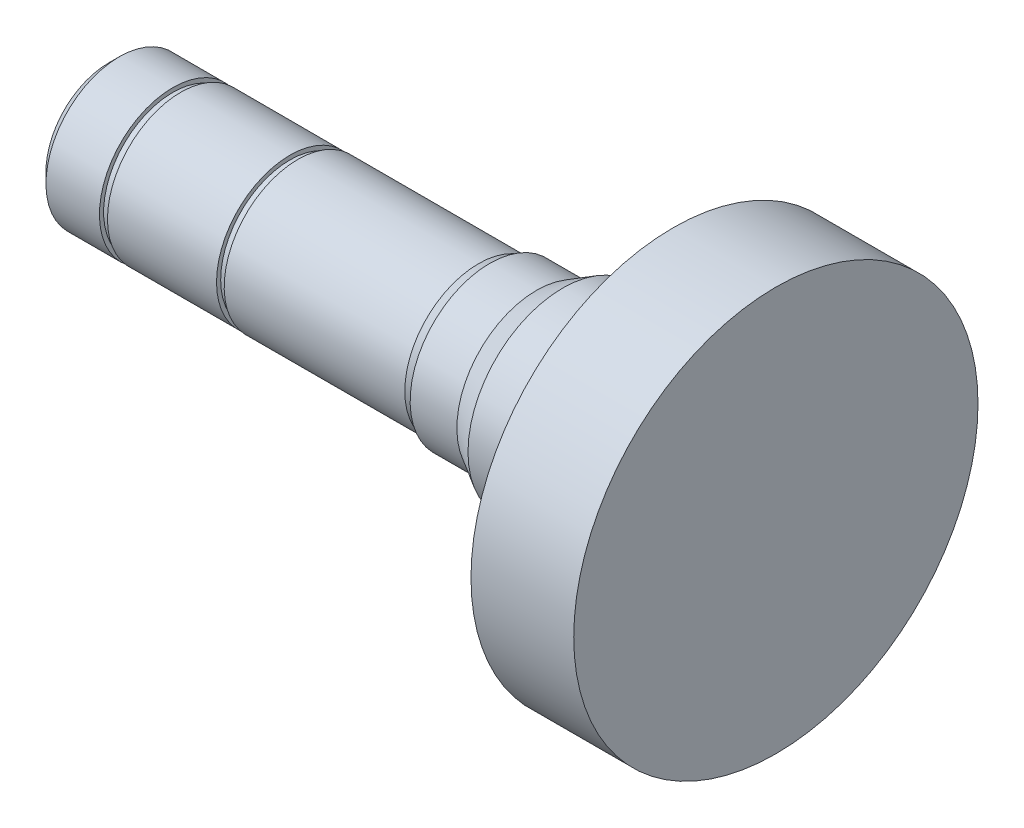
SolidWorks part; units mm, degrees
ref_plane "Plan de face" through (0, 0, 0) normal (0, 0, 1) x (1, 0, 0)
ref_plane "Plan de dessus" through (0, 0, 0) normal (0, 1, 0) x (1, 0, 0)
ref_plane "Plan de droite" through (0, 0, 0) normal (1, 0, 0) x (0, 0, -1)
imported_body "Importée3"
ref_plane "Plan1" through (44.9, 0, 0) normal (1, 0, 0) x (0, 0, -1)
sketch "Esquisse1" plane through (44.9, 0, 0) normal (1, 0, 0) x (0, 0, -1)
  line L0 (2.9725, 16.169) -> (2.9725, 17.1696)
  line L1 (-2.9725, 17.1696) -> (-2.9725, 16.169)
  arc A0 (2.9725, 17.1696) -> (-2.9725, 17.1696) centre (0, 0) ccw
  arc A1 (-2.9725, 16.169) -> (2.9725, 16.169) centre (0, 0) cw
extrude "Enlèv. mat.-Extru.1" cut sketch "Esquisse1" against normal blind 0.9
sketch "Esquisse2" plane through (44.9, 0, 0) normal (1, 0, 0) x (0, 0, -1)
  line L0 (-10.0389, -14.2426) -> (-9.3314, -13.5351)
  line L1 (-13.5351, -9.3314) -> (-14.2426, -10.0389)
  arc A0 (-14.2426, -10.0389) -> (-10.0389, -14.2426) centre (0, 0) ccw
  arc A1 (-9.3314, -13.5351) -> (-13.5351, -9.3314) centre (0, 0) cw
extrude "Enlèv. mat.-Extru.2" cut sketch "Esquisse2" against normal blind 0.9
sketch "Esquisse3" plane through (44.9, 0, 0) normal (1, 0, 0) x (0, 0, -1)
  line L0 (-2.9725, -16.169) -> (-2.9725, -17.1696)
  line L1 (2.9725, -17.1696) -> (2.9725, -16.169)
  arc A0 (-2.9725, -17.1696) -> (2.9725, -17.1696) centre (0, 0) ccw
  arc A1 (2.9725, -16.169) -> (-2.9725, -16.169) centre (0, 0) cw
extrude "Enlèv. mat.-Extru.3" cut sketch "Esquisse3" against normal blind 0.9
sketch "Esquisse4" plane through (44.9, 0, 0) normal (1, 0, 0) x (0, 0, -1)
  line L0 (-14.2426, 10.0389) -> (-13.5351, 9.3314)
  line L1 (-9.3314, 13.5351) -> (-10.0389, 14.2426)
  arc A0 (-10.0389, 14.2426) -> (-14.2426, 10.0389) centre (0, 0) ccw
  arc A1 (-13.5351, 9.3314) -> (-9.3314, 13.5351) centre (0, 0) cw
extrude "Enlèv. mat.-Extru.4" cut sketch "Esquisse4" against normal blind 0.9
sketch "Esquisse5" plane through (44.9, 0, 0) normal (1, 0, 0) x (0, 0, -1)
  line L0 (-17.1696, -2.9725) -> (-16.169, -2.9725)
  line L1 (-16.169, 2.9725) -> (-17.1696, 2.9725)
  arc A0 (-17.1696, 2.9725) -> (-17.1696, -2.9725) centre (0, 0) ccw
  arc A1 (-16.169, -2.9725) -> (-16.169, 2.9725) centre (0, 0) cw
extrude "Enlèv. mat.-Extru.5" cut sketch "Esquisse5" against normal blind 0.9
sketch "Esquisse6" plane through (44.9, 0, 0) normal (1, 0, 0) x (0, 0, -1)
  line L0 (9.3314, -13.5351) -> (10.0389, -14.2426)
  line L1 (14.2426, -10.0389) -> (13.5351, -9.3314)
  arc A0 (13.5351, -9.3314) -> (9.3314, -13.5351) centre (0, 0) cw
  arc A1 (10.0389, -14.2426) -> (14.2426, -10.0389) centre (0, 0) ccw
extrude "Enlèv. mat.-Extru.6" cut sketch "Esquisse6" against normal blind 0.9
sketch "Esquisse7" plane through (44.9, 0, 0) normal (1, 0, 0) x (0, 0, -1)
  line L0 (10.0389, 14.2426) -> (9.3314, 13.5351)
  line L1 (13.5351, 9.3314) -> (14.2426, 10.0389)
  arc A0 (14.2426, 10.0389) -> (10.0389, 14.2426) centre (0, 0) ccw
  arc A1 (9.3314, 13.5351) -> (13.5351, 9.3314) centre (0, 0) cw
extrude "Enlèv. mat.-Extru.7" cut sketch "Esquisse7" against normal blind 0.9
sketch "Esquisse8" plane through (44.9, 0, 0) normal (1, 0, 0) x (0, 0, -1)
  line L0 (17.1696, 2.9725) -> (16.169, 2.9725)
  line L1 (16.169, -2.9725) -> (17.1696, -2.9725)
  arc A0 (17.1696, -2.9725) -> (17.1696, 2.9725) centre (0, 0) ccw
  arc A1 (16.169, 2.9725) -> (16.169, -2.9725) centre (0, 0) cw
extrude "Enlèv. mat.-Extru.8" cut sketch "Esquisse8" against normal blind 0.9
sketch "Esquisse9" plane through (44, 0, 0) normal (1, 0, 0) x (0, 0, -1)
  line L0 (10.0389, 14.2426) -> (9.3314, 13.5351)
  line L1 (13.5351, 9.3314) -> (14.2426, 10.0389)
  arc A0 (14.2426, 10.0389) -> (10.0389, 14.2426) centre (0, 0) ccw
  arc A1 (9.3314, 13.5351) -> (13.5351, 9.3314) centre (0, 0) cw
extrude "Enlèv. mat.-Extru.9" cut sketch "Esquisse9" against normal blind 1
sketch "Esquisse10" plane through (44, 0, 0) normal (1, 0, 0) x (0, 0, -1)
  line L0 (17.1696, 2.9725) -> (16.169, 2.9725)
  line L1 (16.169, -2.9725) -> (17.1696, -2.9725)
  arc A0 (17.1696, -2.9725) -> (17.1696, 2.9725) centre (0, 0) ccw
  arc A1 (16.169, 2.9725) -> (16.169, -2.9725) centre (0, 0) cw
extrude "Enlèv. mat.-Extru.10" cut sketch "Esquisse10" against normal blind 1
sketch "Esquisse11" plane through (44, 0, 0) normal (1, 0, 0) x (0, 0, -1)
  line L0 (9.3314, -13.5351) -> (10.0389, -14.2426)
  line L1 (14.2426, -10.0389) -> (13.5351, -9.3314)
  arc A0 (13.5351, -9.3314) -> (9.3314, -13.5351) centre (0, 0) cw
  arc A1 (10.0389, -14.2426) -> (14.2426, -10.0389) centre (0, 0) ccw
extrude "Enlèv. mat.-Extru.11" cut sketch "Esquisse11" against normal blind 1
sketch "Esquisse12" plane through (44, 0, 0) normal (1, 0, 0) x (0, 0, -1)
  line L0 (-17.1696, -2.9725) -> (-16.169, -2.9725)
  line L1 (-16.169, 2.9725) -> (-17.1696, 2.9725)
  arc A0 (-17.1696, 2.9725) -> (-17.1696, -2.9725) centre (0, 0) ccw
  arc A1 (-16.169, -2.9725) -> (-16.169, 2.9725) centre (0, 0) cw
extrude "Enlèv. mat.-Extru.12" cut sketch "Esquisse12" against normal blind 1
sketch "Esquisse13" plane through (44, 0, 0) normal (1, 0, 0) x (0, 0, -1)
  line L0 (-14.2426, 10.0389) -> (-13.5351, 9.3314)
  line L1 (-9.3314, 13.5351) -> (-10.0389, 14.2426)
  arc A0 (-10.0389, 14.2426) -> (-14.2426, 10.0389) centre (0, 0) ccw
  arc A1 (-13.5351, 9.3314) -> (-9.3314, 13.5351) centre (0, 0) cw
extrude "Enlèv. mat.-Extru.13" cut sketch "Esquisse13" against normal blind 1
sketch "Esquisse14" plane through (44, 0, 0) normal (1, 0, 0) x (0, 0, -1)
  line L0 (-2.9725, -16.169) -> (-2.9725, -17.1696)
  line L1 (2.9725, -17.1696) -> (2.9725, -16.169)
  arc A0 (-2.9725, -17.1696) -> (2.9725, -17.1696) centre (0, 0) ccw
  arc A1 (2.9725, -16.169) -> (-2.9725, -16.169) centre (0, 0) cw
extrude "Enlèv. mat.-Extru.14" cut sketch "Esquisse14" against normal blind 1
sketch "Esquisse15" [suppressed] plane through (44, 0, 0) normal (1, 0, 0) x (0, 0, -1)
  line L0 (-10.0389, -14.2426) -> (-9.3314, -13.5351)
  line L1 (-13.5351, -9.3314) -> (-14.2426, -10.0389)
  arc A0 (-14.2426, -10.0389) -> (-10.0389, -14.2426) centre (0, 0) ccw
  arc A1 (-9.3314, -13.5351) -> (-13.5351, -9.3314) centre (0, 0) cw
extrude "Enlèv. mat.-Extru.15" [suppressed] cut sketch "Esquisse15" against normal blind 1
sketch "Esquisse16" [suppressed] plane through (44, 0, 0) normal (1, 0, 0) x (0, 0, -1)
  line L0 (2.9725, 16.169) -> (2.9725, 17.1696)
  line L1 (-2.9725, 17.1696) -> (-2.9725, 16.169)
  arc A0 (2.9725, 17.1696) -> (-2.9725, 17.1696) centre (0, 0) ccw
  arc A1 (-2.9725, 16.169) -> (2.9725, 16.169) centre (0, 0) cw
extrude "Enlèv. mat.-Extru.16" [suppressed] cut sketch "Esquisse16" against normal blind 1
ref_plane "Plan2" through (15.2, 0, 0) normal (-1, 0, 0) x (0, -1, 0)
sketch "Esquisse17" plane through (15.2, 0, 0) normal (-1, 0, 0) x (0, -1, 0)
  line L0 (16.169, -2.9725) -> (17.1696, -2.9725)
  line L1 (17.1696, 2.9725) -> (16.169, 2.9725)
  arc A0 (16.169, 2.9725) -> (16.169, -2.9725) centre (0, 0) cw
  arc A1 (17.1696, -2.9725) -> (17.1696, 2.9725) centre (0, 0) ccw
extrude "Enlèv. mat.-Extru.17" cut sketch "Esquisse17" against normal blind 1.9
sketch "Esquisse18" plane through (15.2, 0, 0) normal (-1, 0, 0) x (0, -1, 0)
  line L0 (10.0389, 14.2426) -> (9.3314, 13.5351)
  line L1 (13.5351, 9.3314) -> (14.2426, 10.0389)
  arc A0 (14.2426, 10.0389) -> (10.0389, 14.2426) centre (0, 0) ccw
  arc A1 (9.3314, 13.5351) -> (13.5351, 9.3314) centre (0, 0) cw
extrude "Enlèv. mat.-Extru.18" cut sketch "Esquisse18" against normal blind 1.9
ref_plane "Plan3" through (17.1, 0, 0) normal (1, 0, 0) x (0, 0, -1)
sketch "Esquisse19" plane through (17.1, 0, 0) normal (1, 0, 0) x (0, 0, -1)
  line L0 (-14.2426, 10.0389) -> (-13.5351, 9.3314)
  line L1 (-9.3314, 13.5351) -> (-10.0389, 14.2426)
  arc A0 (-10.0389, 14.2426) -> (-14.2426, 10.0389) centre (0, 0) ccw
  arc A1 (-13.5351, 9.3314) -> (-9.3314, 13.5351) centre (0, 0) cw
extrude "Enlèv. mat.-Extru.19" cut sketch "Esquisse19" against normal blind 1.9
sketch "Esquisse20" plane through (15.2, 0, 0) normal (-1, 0, 0) x (0, -1, 0)
  line L0 (-2.9725, 17.1696) -> (-2.9725, 16.169)
  line L1 (2.9725, 16.169) -> (2.9725, 17.1696)
  arc A0 (2.9725, 17.1696) -> (-2.9725, 17.1696) centre (0, 0) ccw
  arc A1 (-2.9725, 16.169) -> (2.9725, 16.169) centre (0, 0) cw
extrude "Enlèv. mat.-Extru.20" cut sketch "Esquisse20" against normal blind 1.9
sketch "Esquisse21" plane through (15.2, 0, 0) normal (-1, 0, 0) x (0, -1, 0)
  line L0 (9.3314, -13.5351) -> (10.0389, -14.2426)
  line L1 (14.2426, -10.0389) -> (13.5351, -9.3314)
  arc A0 (10.0389, -14.2426) -> (14.2426, -10.0389) centre (0, 0) ccw
  arc A1 (13.5351, -9.3314) -> (9.3314, -13.5351) centre (0, 0) cw
extrude "Enlèv. mat.-Extru.21" cut sketch "Esquisse21" against normal blind 1.9
sketch "Esquisse22" plane through (15.2, 0, 0) normal (-1, 0, 0) x (0, -1, 0)
  line L0 (2.9725, -17.1696) -> (2.9725, -16.169)
  line L1 (-2.9725, -16.169) -> (-2.9725, -17.1696)
  arc A0 (-2.9725, -17.1696) -> (2.9725, -17.1696) centre (0, 0) ccw
  arc A1 (2.9725, -16.169) -> (-2.9725, -16.169) centre (0, 0) cw
extrude "Enlèv. mat.-Extru.22" cut sketch "Esquisse22" against normal blind 1.9
sketch "Esquisse23" plane through (15.2, 0, 0) normal (-1, 0, 0) x (0, -1, 0)
  line L0 (-10.0389, -14.2426) -> (-9.3314, -13.5351)
  line L1 (-13.5351, -9.3314) -> (-14.2426, -10.0389)
  arc A0 (-14.2426, -10.0389) -> (-10.0389, -14.2426) centre (0, 0) ccw
  arc A1 (-9.3314, -13.5351) -> (-13.5351, -9.3314) centre (0, 0) cw
extrude "Enlèv. mat.-Extru.23" cut sketch "Esquisse23" against normal blind 1.9
sketch "Esquisse24" plane through (15.2, 0, 0) normal (-1, 0, 0) x (0, -1, 0)
  line L0 (-16.169, 2.9725) -> (-17.1696, 2.9725)
  line L1 (-17.1696, -2.9725) -> (-16.169, -2.9725)
  arc A0 (-16.169, -2.9725) -> (-16.169, 2.9725) centre (0, 0) cw
  arc A1 (-17.1696, 2.9725) -> (-17.1696, -2.9725) centre (0, 0) ccw
extrude "Enlèv. mat.-Extru.24" cut sketch "Esquisse24" against normal blind 1.9
sketch "Esquisse25" plane through (107.8, 0, 0) normal (1, 0, 0) x (0, 0, -1)
  circle A0 centre (0, 0) radius 22.5075
extrude "Boss.-Extru.1" add sketch "Esquisse25" along normal blind 26
ref_plane "Plan4" through (133.8, 0, 0) normal (-1, 0, 0) x (0, -1, 0)
sketch "Esquisse26" plane through (133.8, 0, 0) normal (-1, 0, 0) x (0, -1, 0)
  circle A0 centre (0, 0) radius 32
extrude "Boss.-Extru.2" add sketch "Esquisse26" against normal blind 0.2
ref_plane "Plan5" through (134, 0, 0) normal (-1, 0, 0) x (0, -1, 0)
sketch "Esquisse27" plane through (134, 0, 0) normal (-1, 0, 0) x (0, -1, 0)
  circle A0 centre (0, 0) radius 48
extrude "Boss.-Extru.3" add sketch "Esquisse27" against normal blind 22.4
ref_plane "Plan6" through (0, 0, 31.0515) normal (0, 0, -1) x (-1, 0, 0)
sketch "Esquisse28" plane through (0, 0, 31.0515) normal (0, 0, -1) x (-1, 0, 0)
  line L0 (-156.4, 5.1377) -> (-156.4, -7.0873)
  line L1 (-156.4, -7.0873) -> (-139.4053, -7.0873)
  line L2 (-139.4053, -7.0873) -> (-140.56, -5.0873)
  line L3 (-140.56, -5.0873) -> (-141.06, -5.0873)
  line L4 (-154.968, 4.1377) -> (-155.4, 4.1377)
  line L5 (-155.4, 4.1377) -> (-156.4, 5.1377)
  line L6 (-156.4, -7.0873) -> (-139.4053, -7.0873) construction
  arc A0 (-141.06, -5.0873) -> (-154.968, 4.1377) centre (-152.4, -7.0873) ccw
revolve "Enlèvement de matière-Révolution1" [suppressed] cut sketch "Esquisse28" angle 360 about L6
ref_plane "Plan7" through (0, 0, -24.9013) normal (0, 0, -1) x (-1, 0, 0)
sketch "Esquisse29" plane through (0, 0, -24.9013) normal (0, 0, -1) x (-1, 0, 0)
  line L0 (-156.4, 32.0831) -> (-156.4, 19.8581)
  line L1 (-156.4, 19.8581) -> (-139.4053, 19.8581)
  line L2 (-139.4053, 19.8581) -> (-140.56, 21.8581)
  line L3 (-140.56, 21.8581) -> (-141.06, 21.8581)
  line L4 (-154.968, 31.0831) -> (-155.4, 31.0831)
  line L5 (-155.4, 31.0831) -> (-156.4, 32.0831)
  line L6 (-156.4, 19.8581) -> (-139.4053, 19.8581) construction
  arc A0 (-141.06, 21.8581) -> (-154.968, 31.0831) centre (-152.4, 19.8581) ccw
revolve "Enlèvement de matière-Révolution2" [suppressed] cut sketch "Esquisse29" angle 360 about L6
ref_plane "Plan8" through (0, 0, 0) normal (0, 0, -1) x (-1, 0, 0)
sketch "Esquisse30" plane through (0, 0, 0) normal (0, 0, -1) x (-1, 0, 0)
  line L0 (-156.4, 44.075) -> (-156.4, 31.85)
  line L1 (-156.4, 31.85) -> (-139.4053, 31.85)
  line L2 (-139.4053, 31.85) -> (-140.56, 33.85)
  line L3 (-140.56, 33.85) -> (-141.06, 33.85)
  line L4 (-154.968, 43.075) -> (-155.4, 43.075)
  line L5 (-155.4, 43.075) -> (-156.4, 44.075)
  line L6 (-156.4, 31.85) -> (-139.4053, 31.85) construction
  arc A0 (-141.06, 33.85) -> (-154.968, 43.075) centre (-152.4, 31.85) ccw
revolve "Enlèvement de matière-Révolution3" [suppressed] cut sketch "Esquisse30" angle 360 about L6
ref_plane "Plan9" through (0, 0, 24.9013) normal (0, 0, -1) x (-1, 0, 0)
sketch "Esquisse31" plane through (0, 0, 24.9013) normal (0, 0, -1) x (-1, 0, 0)
  line L0 (-156.4, 32.0832) -> (-156.4, 19.8582)
  line L1 (-156.4, 19.8582) -> (-139.4053, 19.8582)
  line L2 (-139.4053, 19.8582) -> (-140.56, 21.8582)
  line L3 (-140.56, 21.8582) -> (-141.06, 21.8582)
  line L4 (-154.968, 31.0832) -> (-155.4, 31.0832)
  line L5 (-155.4, 31.0832) -> (-156.4, 32.0832)
  line L6 (-156.4, 19.8582) -> (-139.4053, 19.8582) construction
  arc A0 (-141.06, 21.8582) -> (-154.968, 31.0832) centre (-152.4, 19.8582) ccw
revolve "Enlèvement de matière-Révolution4" [suppressed] cut sketch "Esquisse31" angle 360 about L6
ref_plane "Plan10" through (0, 0, -13.8192) normal (0, 0, -1) x (-1, 0, 0)
sketch "Esquisse32" plane through (0, 0, -13.8192) normal (0, 0, -1) x (-1, 0, 0)
  line L0 (-156.4, -16.4709) -> (-156.4, -28.6959)
  line L1 (-156.4, -28.6959) -> (-139.4053, -28.6959)
  line L2 (-139.4053, -28.6959) -> (-140.56, -26.6959)
  line L3 (-140.56, -26.6959) -> (-141.06, -26.6959)
  line L4 (-154.968, -17.4709) -> (-155.4, -17.4709)
  line L5 (-155.4, -17.4709) -> (-156.4, -16.4709)
  line L6 (-156.4, -28.6959) -> (-139.4053, -28.6959) construction
  arc A0 (-141.06, -26.6959) -> (-154.968, -17.4709) centre (-152.4, -28.6959) ccw
revolve "Enlèvement de matière-Révolution5" [suppressed] cut sketch "Esquisse32" angle 360 about L6
ref_plane "Plan11" through (0, 0, -31.0515) normal (0, 0, -1) x (-1, 0, 0)
sketch "Esquisse33" plane through (0, 0, -31.0515) normal (0, 0, -1) x (-1, 0, 0)
  line L0 (-156.4, 5.1377) -> (-156.4, -7.0873)
  line L1 (-156.4, -7.0873) -> (-139.4053, -7.0873)
  line L2 (-139.4053, -7.0873) -> (-140.56, -5.0873)
  line L3 (-140.56, -5.0873) -> (-141.06, -5.0873)
  line L4 (-154.968, 4.1377) -> (-155.4, 4.1377)
  line L5 (-155.4, 4.1377) -> (-156.4, 5.1377)
  line L6 (-156.4, -7.0873) -> (-139.4053, -7.0873) construction
  arc A0 (-141.06, -5.0873) -> (-154.968, 4.1377) centre (-152.4, -7.0873) ccw
revolve "Enlèvement de matière-Révolution6" [suppressed] cut sketch "Esquisse33" angle 360 about L6
ref_plane "Plan12" through (0, 0, 13.8192) normal (0, 0, -1) x (-1, 0, 0)
sketch "Esquisse34" plane through (0, 0, 13.8192) normal (0, 0, -1) x (-1, 0, 0)
  line L0 (-156.4, -16.4709) -> (-156.4, -28.6959)
  line L1 (-156.4, -28.6959) -> (-139.4053, -28.6959)
  line L2 (-139.4053, -28.6959) -> (-140.56, -26.6959)
  line L3 (-140.56, -26.6959) -> (-141.06, -26.6959)
  line L4 (-154.968, -17.4709) -> (-155.4, -17.4709)
  line L5 (-155.4, -17.4709) -> (-156.4, -16.4709)
  line L6 (-156.4, -28.6959) -> (-139.4053, -28.6959) construction
  arc A0 (-141.06, -26.6959) -> (-154.968, -17.4709) centre (-152.4, -28.6959) ccw
revolve "Enlèvement de matière-Révolution7" [suppressed] cut sketch "Esquisse34" angle 360 about L6
sketch "Esquisse35" plane through (0, 0, 0) normal (0, 0, -1) x (-1, 0, 0)
  line L0 (-156.4, 11.8024) -> (-156.4, 0)
  line L1 (-156.4, 0) -> (-139.4053, 0)
  line L2 (-139.4053, 0) -> (-140.56, 2)
  line L3 (-140.56, 2) -> (-141.06, 2)
  line L4 (-154.968, 11.225) -> (-155.4, 11.225)
  line L5 (-155.4, 11.225) -> (-156.4, 11.8024)
  line L6 (-156.4, 0) -> (-139.4053, 0) construction
  arc A0 (-141.06, 2) -> (-154.968, 11.225) centre (-152.4, 0) ccw
revolve "Enlèvement de matière-Révolution8" [suppressed] cut sketch "Esquisse35" angle 360 about L6
hole_wizard "Dégagement M101" positions "Esquisse37" profile "Esquisse36" hole size "M10" standard "Ansi Metric"
sketch "Esquisse37" plane through (0, 0, 0) normal (-1, 0, 0) x (0, 0, 1)
  point P0 (0, 0)
sketch "Esquisse36" plane through (0, 0, 0) normal (0, 1, 0) x (0, 0, 1)
  line L0 (0, 0) -> (0, 31.0735)
  line L1 (0, 31.0735) -> (5.3235, 28)
  line L2 (5.3235, 28) -> (5.3235, 0)
  line L5 (5.3235, 0) -> (0, 0)
  line L10 (0, 31.0735) -> (-5.3235, 28) construction
  line L11 (0, -6.35) -> (0, 107.95) construction
  dimension "Diamètre du perçage" = 10.647
  dimension "Profondeur du perçage" = 28
  dimension "Angle de pointe" = 120
chamfer "Chanfrein1" distance 1.7321 angle 60 1 edges at (0, 0, 5.3235)
chamfer "Chanfrein2" distance 0.4283 angle 45 24 edges at (30.05, 2.9725, -17.1696) (30.55, 17.1696, 2.9725) (30.05, 14.2426, -10.0389) (8.85, -2.9725, -17.1696) (8.85, 10.0389, -14.2426) (8.85, 17.1696, -2.9725) (8.85, 2.9725, 17.1696) (30.05, -2.9725, -17.1696) (30.05, 2.9725, 17.1696) (8.85, -10.0389, 14.2426) (30.05, 10.0389, -14.2426) (30.05, 10.0389, 14.2426) (30.55, -10.0389, 14.2426) (30.55, 17.1696, -2.9725) (30.55, -14.2426, 10.0389) (8.85, -17.1696, 2.9725) (30.05, -17.1696, 2.9725) (30.05, -17.1696, -2.9725) (8.85, 14.2426, 10.0389) (30.05, 14.2426, 10.0389) (30.05, -2.9725, 17.1696) (8.85, -14.2426, -10.0389) (30.05, -14.2426, -10.0389) (30.05, -10.0389, -14.2426)
chamfer "Chanfrein3" distance 0.4283 angle 45 8 edges at (8.85, 10.0389, 14.2426) (8.85, -10.0389, -14.2426) (8.85, 2.9725, -17.1696) (8.85, 14.2426, -10.0389) (8.85, 17.1696, 2.9725) (8.85, -14.2426, 10.0389) (8.85, -17.1696, -2.9725) (8.85, -2.9725, 17.1696)
fillet "Congé1" radius 1.2 1 edges at (133.8, 0, -22.5075)
sketch "Esquisse38" plane through (0, 0, 0) normal (0, 0, 1) x (1, 0, 0)
  line L0 (59.558, 0) -> (-3.764, 0) construction
  line L1 (53.823, 17.5075) -> (44.9, 17.5075)
  line L3 (87.7897, 17.5075) -> (44.9, 17.5075) construction
  line L4 (44.9, 17.5075) -> (44.9, 16.44)
  line L5 (44.9, 13.9997) -> (44.9, 10.5131) construction
  line L6 (44.9, 16.44) -> (43, 16.44)
  line L8 (43, 16.44) -> (43, 17.425)
  line L10 (43, 17.425) -> (17.1, 17.425)
  line L11 (17.1, 17.425) -> (17.1, 16.44)
  line L13 (17.1, 16.44) -> (15.2, 16.44)
  line L14 (15.2, 16.44) -> (15.2, 17.425)
  line L15 (15.2, 17.425) -> (2.5, 17.425)
  line L16 (2.5, 17.425) -> (0, 14.925)
  line L17 (0, 14.925) -> (0, 0)
  line L21 (53.823, 17.5075) -> (53.823, 0)
  line L22 (0, 0) -> (53.823, 0)
  line L23 (43, 9.3314) -> (43, 13.5351) construction
  dimension "D1" = 16.44
revolve "Révolution3" add sketch "Esquisse38" angle 360 about L0
sketch "Esquisse39" plane through (0, 0, 0) normal (0, 0, 1) x (1, 0, 0)
  line L0 (52.1738, 0) -> (-2.6762, 0) construction
  line L1 (43, 16.169) -> (43, 16.6439) construction
  line L2 (0, 14.925) -> (0, -14.925) construction
  line L3 (44.9, 17.5075) -> (43, 17.5075)
  line L6 (44.9, 17.5075) -> (44.9, 16.44)
  line L8 (44.9, 16.44) -> (43, 16.44)
  line L9 (43, 17.5075) -> (43, 16.44)
  line L10 (44.9, 16.44) -> (44, 16.44) construction
revolve "Enlèvement de matière-Révolution9" cut sketch "Esquisse39" angle 360 about L0
sketch "Esquisse41" plane through (0, 0, 0) normal (0, 0, 1) x (1, 0, 0)
  line L0 (146.0444, 0) -> (178.0481, 0) construction
  line L1 (156.4, 48) -> (158.4, 48)
  line L2 (158.4, 48) -> (158.4, 0)
  line L3 (156.4, 48) -> (156.4, 0)
  line L4 (156.4, -48) -> (156.4, 48) construction
  line L5 (156.4, 0) -> (158.4, 0)
  dimension "D1" = 2
revolve "Révolution5" add sketch "Esquisse41" angle 360 about L0
hole_wizard "Diamètre du perçage Ø10.0 (10)1" positions "Esquisse42" profile "Esquisse43" hole size "Ø10.0" standard "ISO"
sketch "Esquisse42" plane through (0, 0, 0) normal (-1, 0, 0) x (0, 0, 1)
  point P0 (0, 0)
sketch "Esquisse43" plane through (0, 0, 0) normal (0, 1, 0) x (0, 0, 1)
  line L0 (0, 0) -> (0, 31.1996)
  line L1 (0, 31.1996) -> (5.325, 28)
  line L2 (5.325, 28) -> (5.325, 0)
  line L5 (5.325, 0) -> (0, 0)
  line L10 (0, 31.1996) -> (-5.325, 28) construction
  line L11 (0, -6.35) -> (0, 107.95) construction
  dimension "Diamètre du perçage" = 10.65
  dimension "Profondeur du perçage" = 28
  dimension "Angle de pointe" = 118
sketch "Esquisse44" plane through (0, 0, 0) normal (0, 0, 1) x (1, 0, 0)
  line L0 (0, -7.055) -> (3, -5.325)
  line L1 (0, 14.925) -> (0, -14.925) construction
  line L2 (-3.1159, 0) -> (-13.7659, 0) construction
  line L3 (0, -7.055) -> (0, -5.325)
  line L4 (3, -5.325) -> (0, -5.325)
  dimension "D1" = 10.65
  dimension "D2" = 14.11
  dimension "D4" = 3
revolve "Enlèvement de matière-Révolution10" cut sketch "Esquisse44" angle 360 about L2
